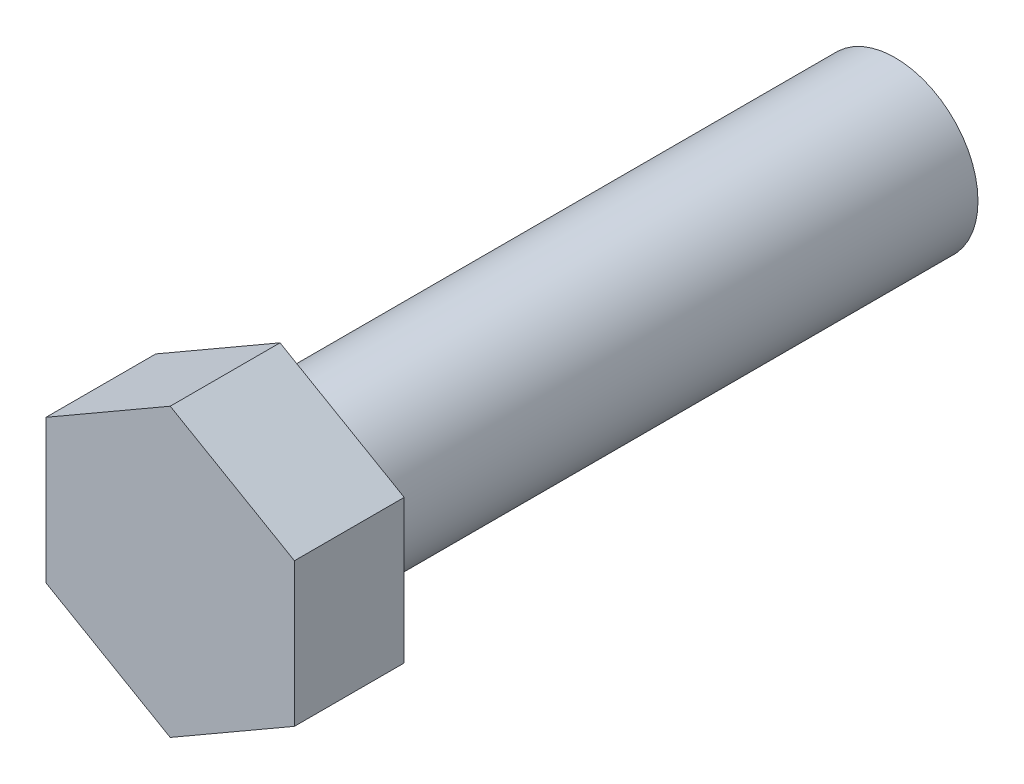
SolidWorks part; units mm, degrees
ref_plane "Front Plane" through (0, 0, 0) normal (1, 0, 0) x (0, 1, 0)
ref_plane "Top Plane" through (0, 0, 0) normal (0, 0, 1) x (0, 1, 0)
ref_plane "Right Plane" through (0, 0, 0) normal (0, 1, 0) x (-1, 0, 0)
sketch "Sketch1"
sketch_block_instance "W14x730-1-1"
sketch_block "W14x730-1" parameters "D4"=15.24, "D1"=454.406, "D2"=569.468, "D3"=77.978, "D5"=124.714
sketch "sk body" plane through (0, 0, 0) normal (0, 0, 1) x (0, 1, 0)
  circle A0 centre (0, 0) radius 22.225
  dimension "D1" = 44.45
sketch "sk Max dia" plane through (0, 0, 0) normal (0, 0, 1) x (0, 1, 0)
  circle A0 centre (0, 0) radius 52.2097
  dimension "D1" = 104.4194
sketch "Sketch3" plane through (0, 0, 0) normal (0, 0, 1) x (0, 1, 0)
  line L1 (38.4948, 0) -> (19.2474, 33.3375)
  line L2 (19.2474, 33.3375) -> (-19.2474, 33.3375)
  line L3 (-19.2474, 33.3375) -> (-38.4948, 0)
  line L4 (-38.4948, 0) -> (-19.2474, -33.3375)
  line L5 (-19.2474, -33.3375) -> (19.2474, -33.3375)
  line L6 (19.2474, -33.3375) -> (38.4948, 0)
  circle A0 centre (0, 0) radius 33.3375 construction
  dimension "D1" = 66.675
extrude "bolt Head" add sketch "Sketch3" along normal blind 29.464
extrude "bolt Body" add sketch "sk body" against normal blind 165.1
